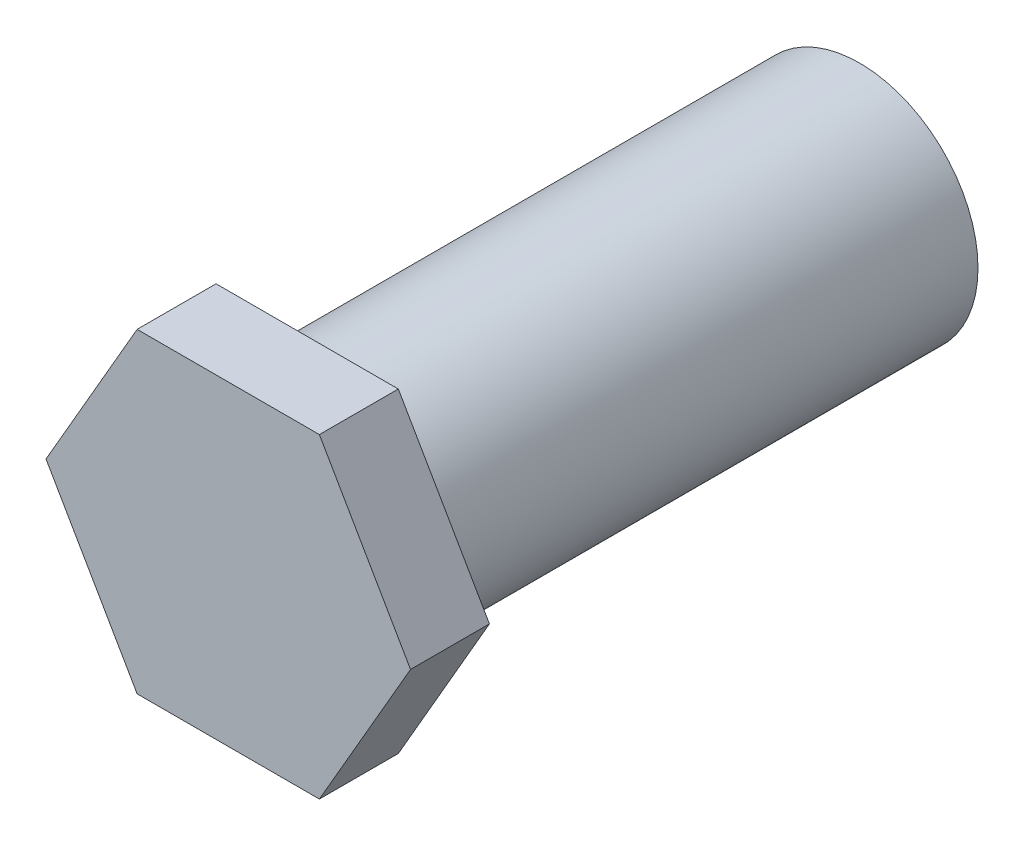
SolidWorks part; units mm, degrees
ref_plane "Front" through (0, 0, 0) normal (0, 0, 1) x (1, 0, 0)
ref_plane "Top" through (0, 0, 0) normal (0, 1, 0) x (1, 0, 0)
ref_plane "Right" through (0, 0, 0) normal (1, 0, 0) x (0, 0, -1)
sketch "Sketch1" plane through (0, 0, 0) normal (0, 0, 1) x (1, 0, 0)
  circle A0 centre (0, 0) radius 7.5
  dimension "D1" = 15
extrude "Extrude1" add sketch "Sketch1" along normal blind 35
sketch "Sketch2" plane through (0, 0, 35) normal (0, 0, 1) x (1, 0, 0)
  line L1 (11.547, 0) -> (5.7735, 10)
  line L2 (5.7735, 10) -> (-5.7735, 10)
  line L3 (-5.7735, 10) -> (-11.547, 0)
  line L4 (-11.547, 0) -> (-5.7735, -10)
  line L5 (-5.7735, -10) -> (5.7735, -10)
  line L6 (5.7735, -10) -> (11.547, 0)
  circle A0 centre (0, 0) radius 10 construction
  dimension "D1" = 20
extrude "Extrude2" add sketch "Sketch2" along normal blind 5
